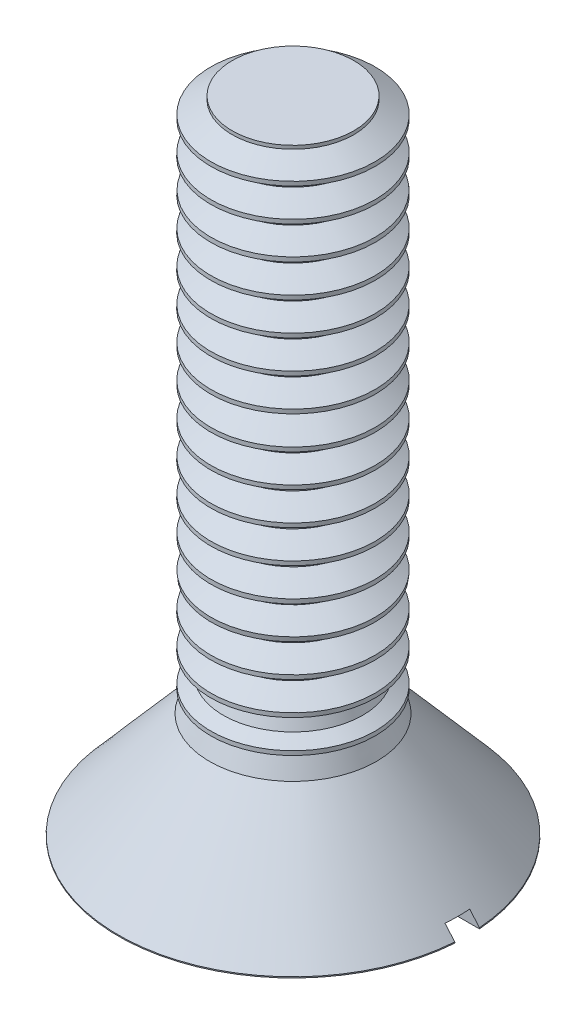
SolidWorks part; units mm, degrees
ref_plane "Спереди" through (0, 0, 0) normal (0, 0, 1) x (1, 0, 0)
ref_plane "Сверху" through (0, 0, 0) normal (0, 1, 0) x (1, 0, 0)
ref_plane "Справа" through (0, 0, 0) normal (1, 0, 0) x (0, 0, -1)
sketch "Эскиз2" plane through (0, 0, 0) normal (0, 0, 1) x (1, 0, 0)
  line L0 (-2.3036, 0.0154) -> (-2.3036, 0.0416)
  line L1 (-6.5522, 0.0154) -> (-6.5522, 0.0416)
  line L2 (-2.3036, 0.0154) -> (-2.3036, 0.0416)
  line L3 (-6.5522, 0.0154) -> (-2.3036, 0.0154)
  line L5 (-6.5522, 0.0416) -> (-4.3354, 2.5917)
  line L6 (-2.3036, 15.609) -> (-2.3036, 0.0416)
  line L8 (-2.3036, -0.7865) -> (-2.3036, 25.8656) construction
  line L9 (-4.3354, 2.5917) -> (-4.1563, 3.024)
  line L10 (-3.7842, 15.609) -> (-2.3036, 15.609)
  line L13 (-4.1563, 3.024) -> (-4.3055, 3.1157)
  line L17 (-4.3055, 3.1157) -> (-4.3039, 3.2158)
  line L21 (-4.3039, 3.2158) -> (-4.0016, 3.3975)
  line L25 (-4.0016, 3.3975) -> (-3.8893, 3.6687)
  line L29 (-3.8893, 3.6687) -> (-4.3055, 3.9158)
  line L33 (-4.3055, 3.9158) -> (-4.3039, 4.0159)
  line L37 (-4.3039, 4.0159) -> (-3.7842, 4.3243)
  line L41 (-3.7842, 4.3243) -> (-3.7842, 4.4159)
  line L45 (-3.7842, 4.4159) -> (-4.3055, 4.7159)
  line L49 (-4.3055, 4.7159) -> (-4.3039, 4.816)
  line L53 (-4.3039, 4.816) -> (-3.7842, 5.1244)
  line L57 (-3.7842, 5.1244) -> (-3.7842, 5.216)
  line L61 (-3.7842, 5.216) -> (-4.2917, 5.5036)
  line L65 (-4.2917, 5.5036) -> (-4.3039, 5.6161)
  line L69 (-4.3039, 5.6161) -> (-3.7842, 5.9245)
  line L73 (-3.7842, 5.9245) -> (-3.7842, 6.0078)
  line L77 (-3.7842, 6.0078) -> (-4.3028, 6.3089)
  line L81 (-4.3028, 6.3089) -> (-4.3039, 6.4162)
  line L85 (-4.3039, 6.4162) -> (-3.7842, 6.7246)
  line L89 (-3.7842, 6.7246) -> (-3.7842, 6.8079)
  line L93 (-3.7842, 6.8079) -> (-4.3055, 7.1162)
  line L97 (-4.3055, 7.1162) -> (-4.3039, 7.2163)
  line L101 (-4.3039, 7.2163) -> (-3.7842, 7.5247)
  line L105 (-3.7842, 7.5247) -> (-3.7842, 7.608)
  line L109 (-3.7842, 7.608) -> (-4.3055, 7.9163)
  line L113 (-4.3055, 7.9163) -> (-4.3039, 8.0164)
  line L117 (-4.3039, 8.0164) -> (-3.7842, 8.3248)
  line L121 (-3.7842, 8.3248) -> (-3.7842, 8.4081)
  line L125 (-3.7842, 8.4081) -> (-4.3039, 8.7165)
  line L129 (-4.3039, 8.7165) -> (-4.3039, 8.8165)
  line L133 (-4.3039, 8.8165) -> (-3.7842, 9.1249)
  line L137 (-3.7842, 9.1249) -> (-3.7842, 9.2082)
  line L141 (-3.7842, 9.2082) -> (-4.3039, 9.5144)
  line L145 (-4.3039, 9.5144) -> (-4.3039, 9.6166)
  line L149 (-4.3039, 9.6166) -> (-3.7842, 10.0083)
  line L153 (-3.7842, 10.0083) -> (-4.3039, 10.3156)
  line L157 (-4.3039, 10.3156) -> (-4.3039, 10.4167)
  line L161 (-4.3039, 10.4167) -> (-3.7842, 10.7251)
  line L165 (-3.7842, 10.7251) -> (-3.7842, 10.8084)
  line L169 (-3.7842, 10.8084) -> (-4.3055, 11.1167)
  line L173 (-4.3055, 11.1167) -> (-4.3039, 11.2168)
  line L177 (-4.3039, 11.2168) -> (-3.7842, 11.5252)
  line L181 (-3.7842, 11.5252) -> (-3.7842, 11.6085)
  line L185 (-3.7842, 11.6085) -> (-4.3055, 11.9168)
  line L189 (-4.3055, 11.9168) -> (-4.3039, 12.0169)
  line L193 (-4.3039, 12.0169) -> (-3.7842, 12.3253)
  line L197 (-3.7842, 12.3253) -> (-3.7842, 12.4086)
  line L201 (-3.7842, 12.4086) -> (-4.3055, 12.7169)
  line L205 (-4.3055, 12.7169) -> (-4.3039, 12.817)
  line L209 (-4.3039, 12.817) -> (-3.7842, 13.1254)
  line L213 (-3.7842, 13.1254) -> (-3.7842, 13.2087)
  line L217 (-3.7842, 13.2087) -> (-4.3055, 13.517)
  line L221 (-4.3055, 13.517) -> (-4.3004, 13.622)
  line L225 (-4.3004, 13.622) -> (-3.7842, 13.9255)
  line L229 (-3.7842, 13.9255) -> (-3.7842, 14.0088)
  line L233 (-3.7842, 14.0088) -> (-4.3055, 14.3171)
  line L237 (-4.3055, 14.3171) -> (-4.3039, 14.4172)
  line L241 (-4.3039, 14.4172) -> (-3.7842, 14.7256)
  line L245 (-3.7842, 14.7256) -> (-3.7842, 14.8089)
  line L249 (-3.7842, 14.8089) -> (-4.3039, 15.1173)
  line L253 (-4.3039, 15.1173) -> (-4.3039, 15.2173)
  line L257 (-4.3039, 15.2173) -> (-3.7842, 15.5257)
  line L261 (-3.7842, 15.5257) -> (-3.7842, 15.609)
revolve "Повернуть5" add sketch "Эскиз2" angle 360 about L8
sketch "Эскиз4" plane through (0, 0.0154, 0) normal (0, -1, 0) x (1, 0, 0)
  line L1 (1.9449, 0) -> (1.9449, -0.3)
  line L2 (1.9449, -0.3) -> (-7.5712, -0.3)
  line L3 (-7.5712, -0.3) -> (-7.5712, 0.2)
  line L4 (-7.5712, 0.2) -> (-7.5712, 0.3)
  line L5 (-7.5712, 0.3) -> (1.9449, 0.3)
  line L6 (1.9449, 0.3) -> (1.9449, 0)
  circle A0 centre (-2.3036, 0) radius 4.2485 construction
extrude "Вырез-Вытянуть1" cut sketch "Эскиз4" against normal blind 0.3
